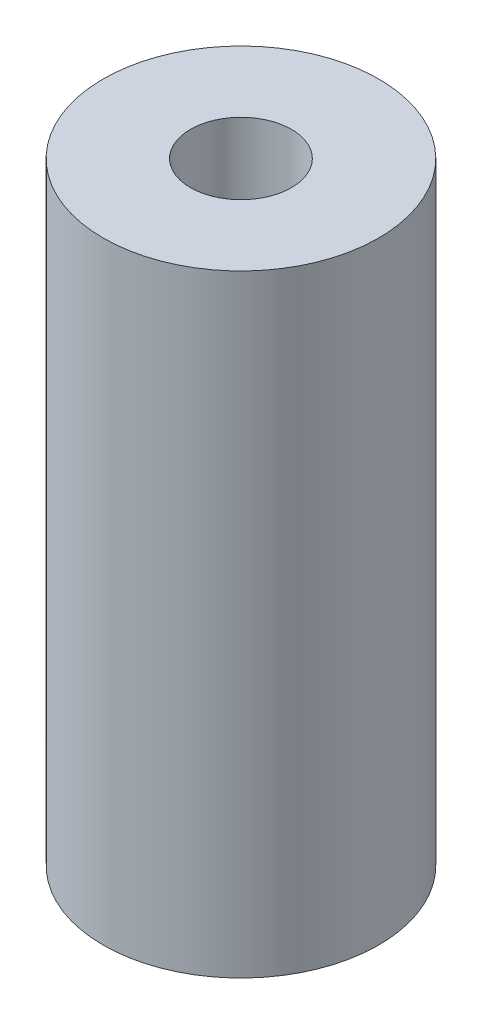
SolidWorks part; units mm, degrees
ref_plane "Front Plane" through (0, 0, 0) normal (0, 0, 1) x (1, 0, 0)
ref_plane "Top Plane" through (0, 0, 0) normal (0, 1, 0) x (1, 0, 0)
ref_plane "Right Plane" through (0, 0, 0) normal (1, 0, 0) x (0, 0, -1)
sketch "Sketch1" plane through (0, 0, 0) normal (0, 1, 0) x (1, 0, 0)
  circle A0 centre (0, 0) radius 3.3
  circle A1 centre (0, 0) radius 9
  dimension "D1" = 6.6
  dimension "D2" = 18
extrude "Boss-Extrude1" add sketch "Sketch1" along normal blind 40
